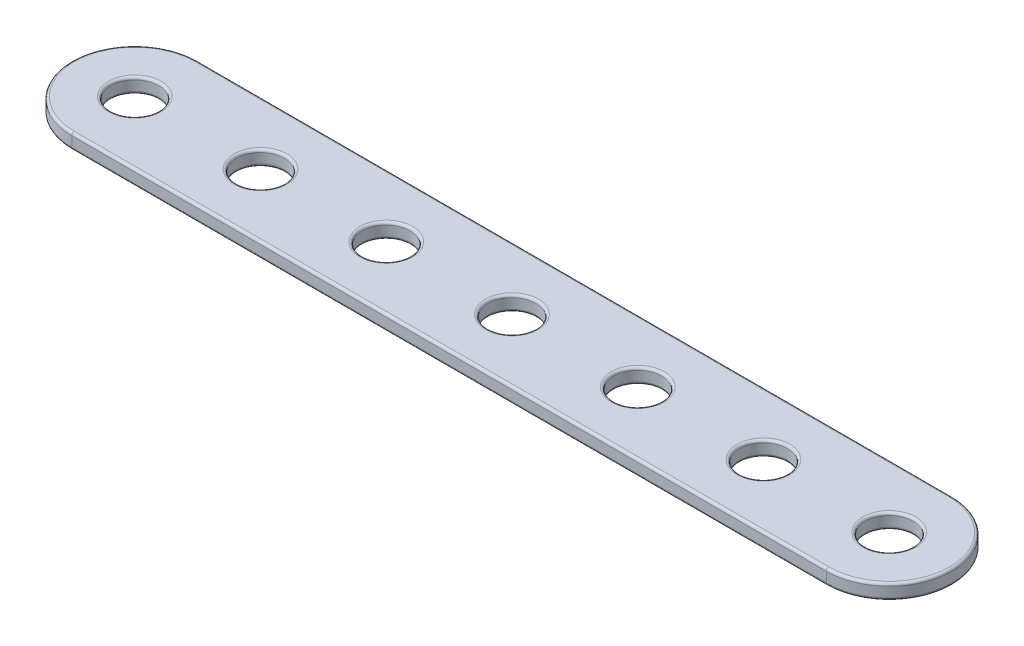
SolidWorks part; units mm, degrees
ref_plane "Front" through (0, 0, 0) normal (0, 0, 1) x (1, 0, 0)
ref_plane "Top" through (0, 0, 0) normal (0, 1, 0) x (1, 0, 0)
ref_plane "Right" through (0, 0, 0) normal (1, 0, 0) x (0, 0, -1)
sketch "Sketch1" plane through (0, 0, 0) normal (0, 1, 0) x (1, 0, 0)
  line L1 (0, 0) -> (76.2, 0)
  line L3 (0, 12.7) -> (76.2, 12.7)
  arc A0 (0, 12.7) -> (0, 0) centre (0, 6.35) ccw
  arc A1 (76.2, 0) -> (76.2, 12.7) centre (76.2, 6.35) ccw
  dimension "D1" = 12.7
  dimension "D2" = 76.2
extrude "Extrude1" add sketch "Sketch1" along normal blind 1.524
sketch "Sketch2" plane through (0, 1.524, 0) normal (0, 1, 0) x (-1, 0, 0)
  line L0 (-76.2, -12.7) -> (0, -12.7) construction
  circle A0 centre (0, -6.35) radius 2.413
  dimension "D2" = 4.826
  dimension "D1" = 6.35
extrude "Cut-Extrude1" cut sketch "Sketch2" against normal through all
pattern_linear "LPattern1" count 7 spacing 12.7 along (1, 0, 0) of "Cut-Extrude1"
fillet "Fillet1" radius 0.254 22 edges at (82.55, 1.524, -6.35) (38.1, 1.524, -12.7) (0, 0, -3.937) (0, 1.524, -3.937) (12.7, 0, -3.937) (12.7, 1.524, -3.937) (25.4, 0, -3.937) (25.4, 1.524, -3.937) (38.1, 0, -3.937) (38.1, 1.524, -3.937) (50.8, 0, -3.937) (50.8, 1.524, -3.937) (63.5, 0, -3.937) (63.5, 1.524, -3.937) (76.2, 0, -3.937) (76.2, 1.524, -3.937) (-6.35, 1.524, -6.35) (38.1, 0, -12.7) (82.55, 0, -6.35) (38.1, 0, 0) (-6.35, 0, -6.35) (38.1, 1.524, 0)
equation "\"D2@Sketch1\" = \"D3@LPattern1\" *  ( \"D1@LPattern1\" - 1 ) "
